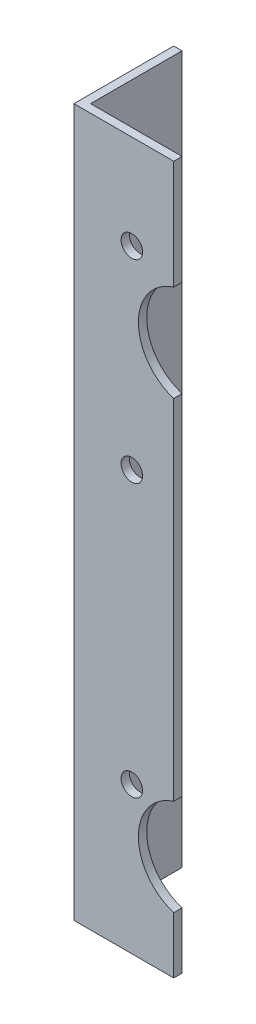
SolidWorks part; units mm, degrees
ref_plane "Front Plane" through (0, 0, 0) normal (0, 0, 1) x (1, 0, 0)
ref_plane "Top Plane" through (0, 0, 0) normal (0, 1, 0) x (1, 0, 0)
ref_plane "Right Plane" through (0, 0, 0) normal (1, 0, 0) x (0, 0, -1)
sketch "Sketch1" plane through (0, 0, 0) normal (0, 1, 0) x (1, 0, 0)
  line L0 (0, 0) -> (19.05, 0)
  line L1 (19.05, 0) -> (19.05, 1.5875)
  line L2 (19.05, 1.5875) -> (1.5875, 1.5875)
  line L3 (1.5875, 1.5875) -> (1.5875, 19.05)
  line L4 (1.5875, 19.05) -> (0, 19.05)
  line L5 (0, 19.05) -> (0, 0)
  dimension "D1" = 19.05
  dimension "D2" = 19.05
  dimension "D3" = 1.5875
  dimension "D4" = 1.5875
extrude "Boss-Extrude1" add sketch "Sketch1" along normal blind 135
sketch "Sketch2" plane through (1.5875, 0, 0) normal (1, 0, 0) x (0, 0, -1)
  line L0 (19.05, 135) -> (19.05, 0) construction
  line L1 (1.5875, 135) -> (19.05, 135) construction
  line L2 (19.05, 135) -> (0, 135) construction
  circle A0 centre (11.05, 117) radius 2.05
  circle A1 centre (11.05, 80) radius 2.05
  circle A2 centre (11.05, 28) radius 2.05
  point P12 (10.3187, 135)
  dimension "D1" = 4.1
  dimension "D2" = 8
  dimension "D3" = 18
  dimension "D4" = 55
  dimension "D5" = 107
extrude "Cut-Extrude1" cut sketch "Sketch2" against normal through all
sketch "Sketch3" plane through (0, 0, -1.5875) normal (0, 0, -1) x (-1, 0, 0)
  line L0 (-19.05, 135) -> (-19.05, 0) construction
  line L2 (-19.05, 135) -> (-1.5875, 135) construction
  circle A0 centre (-11.05, 117) radius 2.05
  circle A1 centre (-11.05, 80) radius 2.05
  circle A2 centre (-11.05, 28) radius 2.05
  dimension "D1" = 8
  dimension "D2" = 4.1
  dimension "D5" = 107
  dimension "D3" = 18
  dimension "D4" = 55
extrude "Cut-Extrude2" cut sketch "Sketch3" against normal through all
sketch "Sketch4" plane through (0, 0, -1.5875) normal (0, 0, -1) x (-1, 0, 0)
  circle A0 centre (-21.95, 105) radius 9.65
  circle A1 centre (-21.95, 20) radius 9.65
extrude "Cut-Extrude3" cut sketch "Sketch4" against normal blind 10
